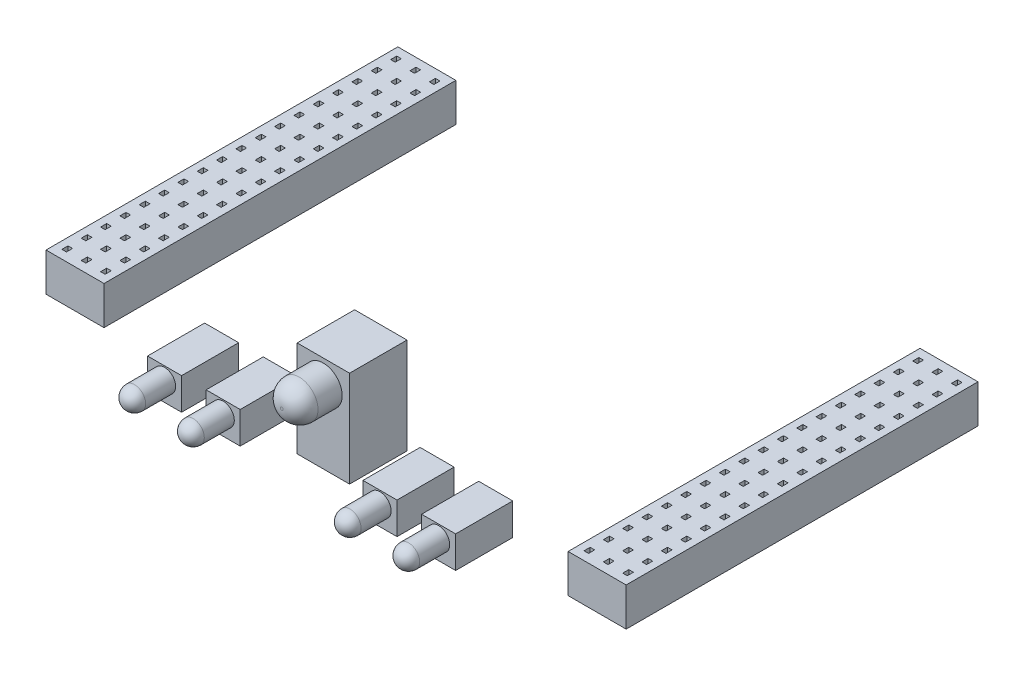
SolidWorks part; units mm, degrees
ref_plane "Front Plane" through (0, 0, 0) normal (0, 0, 1) x (1, 0, 0)
ref_plane "Top Plane" through (0, 0, 0) normal (0, 1, 0) x (1, 0, 0)
ref_plane "Right Plane" through (0, 0, 0) normal (1, 0, 0) x (0, 0, -1)
sketch "Sketch1" plane through (0, 0, 0) normal (0, 1, 0) x (1, 0, 0)
  line L0 (3.81, -23.11) -> (-3.81, -23.11)
  line L1 (3.81, 23.11) -> (3.81, -23.11)
  line L2 (-3.81, 23.11) -> (3.81, 23.11)
  line L3 (-3.81, -23.11) -> (-3.81, 23.11)
  line L4 (0, 23.11) -> (0, -23.11) construction
  dimension "D1" = 7.62
  dimension "D2" = 46.22
extrude "Extrude1" add sketch "Sketch1" along normal mid plane 5.029
sketch "Sketch2" plane through (0, 2.5145, 0) normal (0, 1, 0) x (1, 0, 0)
  line L0 (3.81, 23.11) -> (-3.81, 23.11) construction
  line L1 (3.81, -23.11) -> (3.81, 23.11) construction
  line L12 (2.24, 21.19) -> (2.84, 21.19)
  line L13 (2.84, 21.99) -> (2.84, 21.19)
  line L14 (2.24, 21.99) -> (2.84, 21.99)
  line L15 (2.24, 21.19) -> (2.24, 21.99)
  line L16 (2.24, 21.59) -> (2.84, 21.59) construction
  line L17 (2.54, 21.19) -> (2.54, 21.99) construction
  line L18 (2.54, 21.59) -> (3.81, 21.59) construction
  line L19 (2.54, 21.59) -> (2.54, 23.11) construction
  dimension "D1" = 1.27
  dimension "D2" = 1.52
  dimension "D3" = 0.6
  dimension "D4" = 0.8
extrude "Cut-Extrude1" cut sketch "Sketch2" against normal up to surface (5.029 mm away)
pattern_linear "LPattern1" count 18 spacing 2.54 along (0, 0, 1) count 3 spacing 2.54 along (-1, 0, 0) of "Cut-Extrude1"
sketch "Sketch3" plane through (0, 0, 0) normal (0, 1, 0) x (1, 0, 0)
  line L0 (-3.4417, -3.7719) -> (3.4417, -3.7719)
  line L1 (3.4417, 3.7719) -> (3.4417, -3.7719)
  line L2 (3.4417, 3.7719) -> (-3.4417, 3.7719)
  line L3 (-3.4417, 3.7719) -> (-3.4417, -3.7719)
  line L4 (-3.4417, 0) -> (3.4417, 0) construction
  line L5 (0, -3.7719) -> (0, 3.7719) construction
  dimension "D1" = 7.5438
  dimension "D2" = 6.8834
extrude "Extrude2" add sketch "Sketch3" along normal mid plane 12.6236 separate body
sketch "Sketch4" plane through (0, 0, 3.7719) normal (0, 0, 1) x (1, 0, 0)
  line L0 (0, 3.2642) -> (0, 6.3118) construction
  line L2 (-3.4417, 6.3118) -> (3.4417, 6.3118) construction
  circle A0 centre (0, 3.2642) radius 2.4765
  dimension "D1" = 4.953
  dimension "D2" = 3.0476
extrude "Extrude3" add sketch "Sketch4" along normal blind 3.175
sketch "Sketch5" plane through (0, 0, 0) normal (1, 0, 0) x (0, 0, -1)
  line L0 (-9.2329, 3.2642) -> (-9.2329, 3.4547)
  line L1 (-6.9469, 5.7407) -> (-6.9469, 3.2642) construction
  line L2 (-9.2329, 3.2642) -> (-6.9469, 3.2642) construction
  line L3 (-6.9469, 5.7407) -> (-6.9469, 0.7877) construction
  line L4 (-6.9469, 5.7407) -> (-6.9469, 0.7877) construction
  line L5 (-9.2329, 3.2642) -> (-6.9469, 3.2642)
  line L6 (-6.9469, 3.2642) -> (-6.9469, 5.7407)
  arc A0 (-6.9469, 5.7407) -> (-9.2329, 3.4547) centre (-6.9469, 3.4547) ccw
  dimension "D1" = 2.286
  dimension "D2" = 0.1905
revolve "Revolve1" add sketch "Sketch5" angle 360 about L5
sketch "Sketch6" plane through (0, 0, 0) normal (0, 0, 1) x (1, 0, 0)
  line L0 (2.235, -2.085) -> (-2.235, -2.085)
  line L1 (2.235, 2.085) -> (2.235, -2.085)
  line L2 (-2.235, 2.085) -> (2.235, 2.085)
  line L3 (-2.235, 2.085) -> (-2.235, -2.085)
  line L4 (0, -2.085) -> (0, 2.085) construction
  dimension "D1" = 4.47
  dimension "D2" = 4.17
extrude "Extrude4" add sketch "Sketch6" along normal mid plane 7.5 separate body
sketch "Sketch7" plane through (0, 0, 3.75) normal (0, 0, 1) x (1, 0, 0)
  line L0 (0, 0.455) -> (0, 2.085) construction
  line L1 (2.235, 2.085) -> (-2.235, 2.085) construction
  circle A0 centre (0, 0.455) radius 1.46
  dimension "D2" = 2.92
  dimension "D1" = 1.63
extrude "Extrude5" add sketch "Sketch7" along normal blind 3.94
sketch "Sketch8" plane through (0, 0, 0) normal (1, 0, 0) x (0, 0, -1)
  line L0 (-7.69, 1.915) -> (-7.69, -1.005) construction
  line L1 (-7.69, 1.915) -> (-7.69, -1.005) construction
  line L2 (-3.75, 1.915) -> (-7.69, 1.915) construction
  line L3 (-3.75, 1.915) -> (-7.69, 1.915) construction
  line L4 (-7.69, -1.005) -> (-3.75, -1.005) construction
  line L5 (-7.69, -1.005) -> (-3.75, -1.005) construction
  line L6 (-7.69, 0.455) -> (-9.15, 0.455) construction
  line L7 (-9.15, 0.455) -> (-7.69, 0.455)
  line L8 (-7.69, 0.455) -> (-7.69, 1.915)
  arc A0 (-7.69, 1.915) -> (-9.15, 0.455) centre (-7.69, 0.455) ccw
revolve "Revolve2" add sketch "Sketch8" angle 360 about L7
move or copy body "Body-Move/Copy1" bodies to move or copy 103 placed by mates yes
other "Distance1" parameters "D1"=1.669
other "Distance4" parameters "D1"=27.0413
move or copy body "Body-Move/Copy2" bodies to move or copy 109 placed by mates yes
other "Distance2" parameters "D1"=2.861
other "Distance3" parameters "D1"=4.6233
pattern_linear "LPattern2" count 2 spacing 7.7 along (-1, 0, 0)
mirror "Mirror1" about plane through (0, 0, 0) normal (1, 0, 0)
